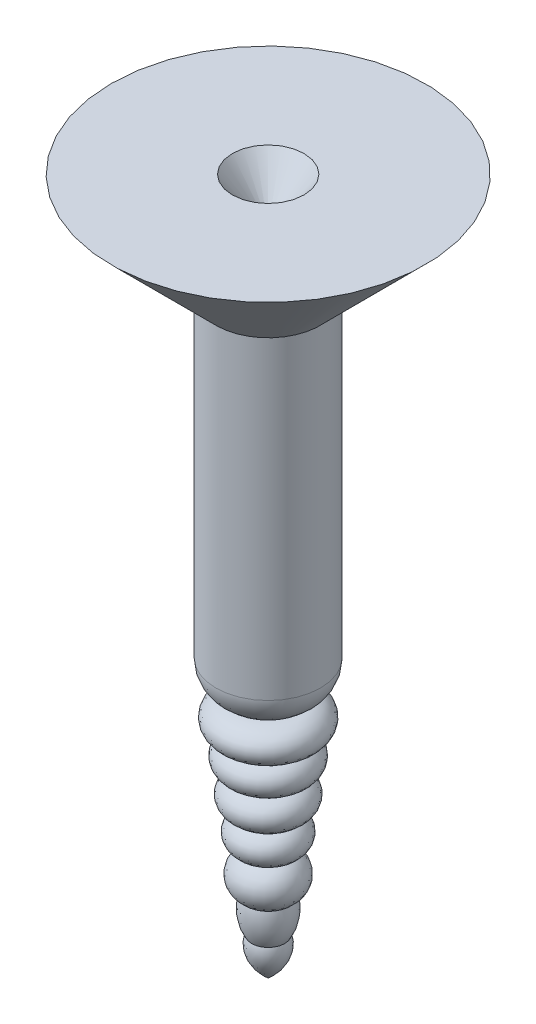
SolidWorks part; units mm, degrees
ref_plane "Front Plane" through (0, 0, 0) normal (0, 0, 1) x (1, 0, 0)
ref_plane "Top Plane" through (0, 0, 0) normal (0, 1, 0) x (1, 0, 0)
ref_plane "Right Plane" through (0, 0, 0) normal (1, 0, 0) x (0, 0, -1)
sketch "Sketch1" plane through (0, 0, 0) normal (0, 0, 1) x (1, 0, 0)
  line L0 (0, -1.6807) -> (0, 8.1775)
  line L14 (-0.5442, 8.8732) -> (0, 8.1775)
  line L15 (-0.7938, 7.2857) -> (-2.3813, 8.8732)
  line L16 (-2.3813, 8.8732) -> (-0.5442, 8.8732)
  line L17 (-0.7938, 7.2857) -> (-0.7938, 2.5232)
  line L18 (0, 8.1775) -> (0, -1.6807) construction
  ellipse E16 centre (-0.176, 0.2427) end of major axis (-0.5047, 0.2427) minor radius 0.2629 (-0.3102, 0.4827) -> (-0.2616, -0.0112) ccw
  ellipse E17 centre (-0.1045, -0.3103) end of major axis (-0.4767, -0.3133) minor radius 0.3303 (-0.2616, -0.0112) -> (-0.3202, -0.5799) ccw
  ellipse E18 centre (-0.2575, 0.7365) end of major axis (0.0641, 0.7365) minor radius 0.2573 (-0.3272, 0.9876) -> (-0.3102, 0.4827) ccw
  ellipse E19 centre (-0.4046, 1.7465) end of major axis (-0.0604, 1.7467) minor radius 0.2622 (-0.3178, 2.0002) -> (-0.4202, 1.4846) ccw
  ellipse E20 centre (-0.3189, 1.2427) end of major axis (-0.6378, 1.2427) minor radius 0.2551 (-0.4202, 1.4846) -> (-0.3272, 0.9876) ccw
  ellipse E21 centre (-0.1901, 2.5238) end of major axis (0.4136, 2.5264) minor radius 0.5356 (-0.7938, 2.5232) -> (-0.3178, 2.0002) ccw
  ellipse E22 centre (1.2727, -1.3681) end of major axis (-0.2682, -1.1825) minor radius 0.7545 (-0.25, -1.1044) -> (0, -1.6807) ccw
  ellipse E23 centre (0.158, -0.7554) end of major axis (0.1459, -1.3495) minor radius 0.5016 (-0.3202, -0.5799) -> (-0.25, -1.1044) ccw
  point P1 (0.0178, 7.9685)
  point P2 (-0.196, -0.5859)
  point P3 (-0.154, -1.1033)
  point P4 (0.1142, -1.6807)
  dimension "D1" = 1.5875
  dimension "D2" = 4.7625
  dimension "D3" = 1.5875
  dimension "D4" = 4.7625
revolve "Revolve1" add sketch "Sketch1" angle 360 about L18
